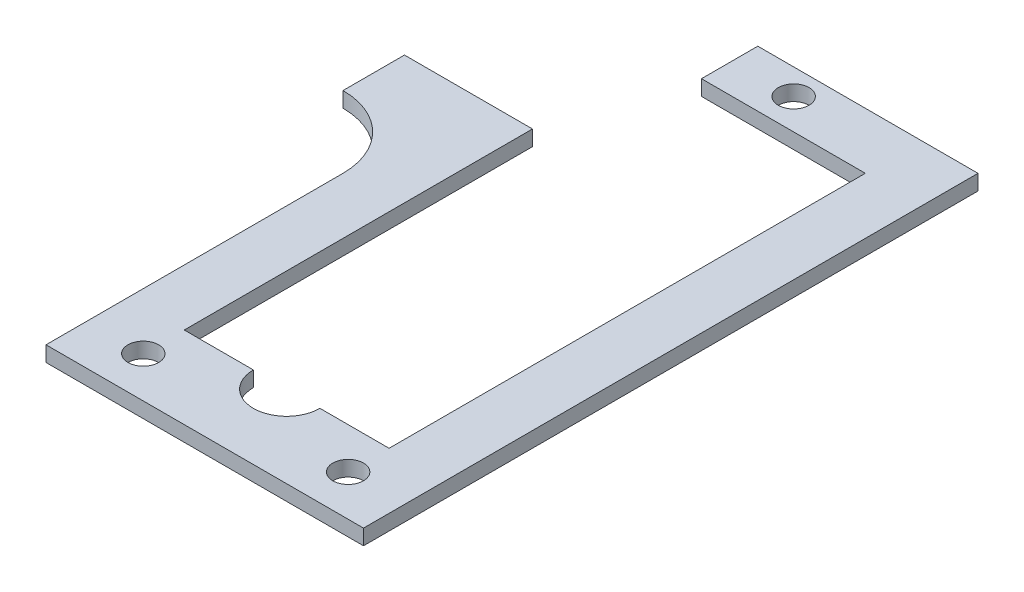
SolidWorks part; units mm, degrees
ref_plane "Front Plane" through (0, 0, 0) normal (0, 0, 1) x (1, 0, 0)
ref_plane "Top Plane" through (0, 0, 0) normal (0, 1, 0) x (1, 0, 0)
ref_plane "Right Plane" through (0, 0, 0) normal (1, 0, 0) x (0, 0, -1)
sketch "Sketch1" plane through (0, 0, 0) normal (0, 1, 0) x (1, 0, 0)
  line L0 (0, 8) -> (62, 8) construction
  line L1 (0, 0) -> (62, 0)
  line L2 (0, 0) -> (0, 58)
  line L3 (19, 120) -> (62, 120)
  line L4 (62, 0) -> (62, 120)
  line L5 (11, 16) -> (24.5, 16)
  line L6 (11, 16) -> (11, 84)
  line L7 (19, 109) -> (51, 109)
  line L8 (51, 16) -> (51, 109)
  line L9 (31, 0) -> (31, 120) construction
  line L10 (11, 84) -> (-14, 84)
  line L11 (-14, 84) -> (-14, 72)
  line L12 (19, 120) -> (19, 109)
  line L13 (37.5, 16) -> (51, 16)
  arc A0 (24.5, 16) -> (37.5, 16) centre (31, 16) ccw
  circle A1 centre (11, 8) radius 3
  circle A2 centre (51, 8) radius 3
  circle A3 centre (31, 115) radius 3
  arc A4 (0, 58) -> (-14, 72) centre (-14, 58) ccw
  dimension "D1" = 6
  dimension "D2" = 6.5
  dimension "D4" = 11
  dimension "D5" = 11
  dimension "D6" = 20
  dimension "D7" = 14
  dimension "D10" = 8
  dimension "D14" = 5
  dimension "D15" = 6
  dimension "D18" = 12
  dimension "D19" = 31
  dimension "D3" = 31
  dimension "D8" = 14
  dimension "D9" = 8
  dimension "D11" = 20
  dimension "D12" = 12
  dimension "D13" = 68
  dimension "D16" = 25
  dimension "D17" = 11
extrude "Extrude1" add sketch "Sketch1" along normal blind 3
